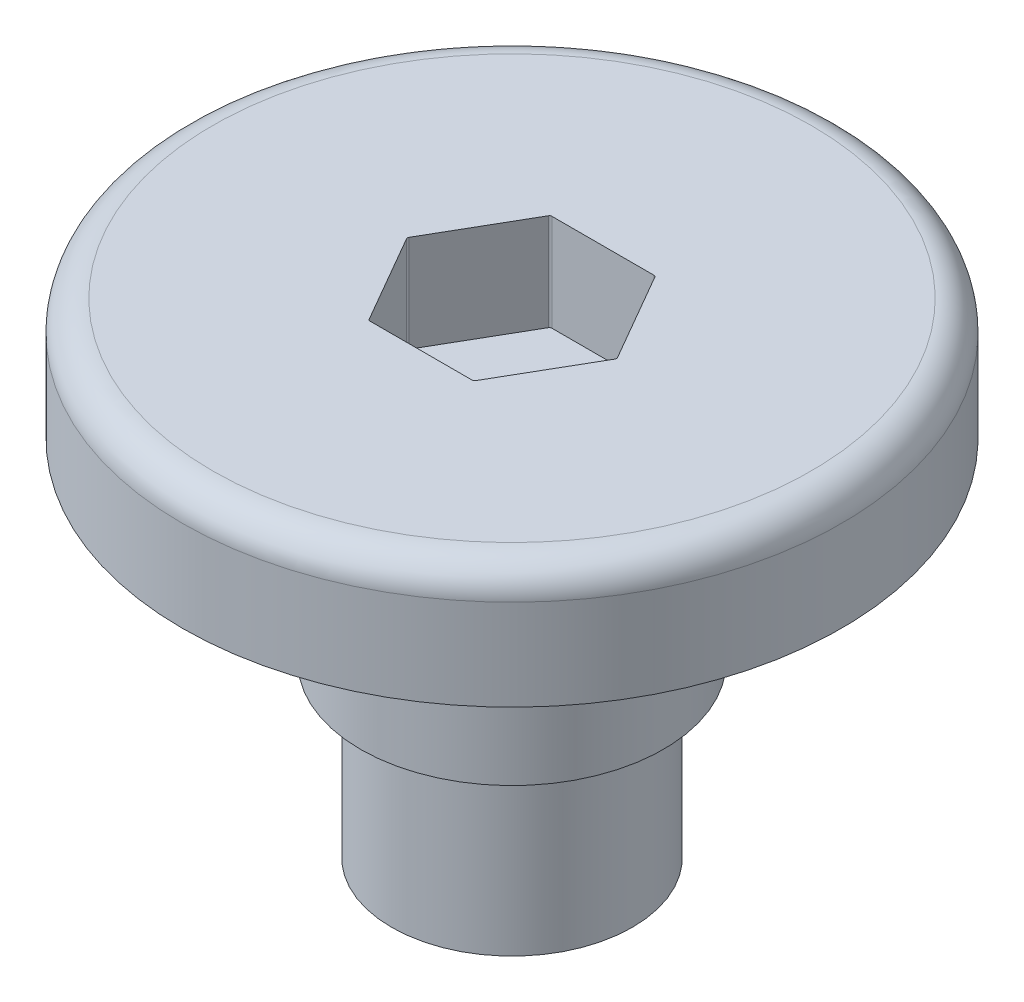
SolidWorks part; units mm, degrees
ref_plane "Front" through (0, 0, 0) normal (0, 0, 1) x (1, 0, 0)
ref_plane "Top" through (0, 0, 0) normal (0, 1, 0) x (1, 0, 0)
ref_plane "Right" through (0, 0, 0) normal (1, 0, 0) x (0, 0, -1)
sketch "Sketch1" plane through (0, 0, 0) normal (0, 0, 1) x (1, 0, 0)
  line L0 (0, 0) -> (0, 71.5624) construction
  line L1 (0, 0) -> (-6.3119, 0)
  line L2 (-7.9375, 8.89) -> (-7.9375, 13.2715)
  line L3 (-7.9375, 19.05) -> (-9.9822, 19.05)
  line L4 (-17.272, 19.05) -> (-17.272, 25.4)
  line L5 (-17.272, 25.4) -> (0, 25.4)
  line L6 (0, 25.4) -> (0, 0)
  line L7 (-10.1092, 19.177) -> (-10.1092, 21.2471)
  line L8 (-10.5537, 21.6916) -> (-14.2875, 21.6916)
  line L9 (-14.732, 21.2471) -> (-14.732, 19.177)
  line L10 (-14.859, 19.05) -> (-17.272, 19.05)
  line L11 (-7.8105, 17.018) -> (-6.1341, 17.018)
  line L12 (-5.8801, 16.764) -> (-5.8801, 13.6525)
  line L13 (-6.1341, 13.3985) -> (-7.8105, 13.3985)
  line L14 (-7.9375, 17.145) -> (-7.9375, 19.05)
  line L15 (-7.9375, 8.89) -> (-6.3119, 8.89)
  line L16 (-7.9375, 19.05) -> (-17.272, 19.304) construction
  line L18 (-6.3119, 8.89) -> (-6.3119, 0)
  arc A0 (-14.2875, 21.6916) -> (-14.732, 21.2471) centre (-14.2875, 21.2471) ccw
  arc A1 (-10.1092, 21.2471) -> (-10.5537, 21.6916) centre (-10.5537, 21.2471) ccw
  arc A2 (-10.1092, 19.177) -> (-9.9822, 19.05) centre (-9.9822, 19.177) ccw
  arc A3 (-14.732, 19.177) -> (-14.859, 19.05) centre (-14.859, 19.177) cw
  arc A4 (-6.1341, 17.018) -> (-5.8801, 16.764) centre (-6.1341, 16.764) cw
  arc A5 (-5.8801, 13.6525) -> (-6.1341, 13.3985) centre (-6.1341, 13.6525) cw
  arc A6 (-7.8105, 17.018) -> (-7.9375, 17.145) centre (-7.8105, 17.145) cw
  arc A7 (-7.8105, 13.3985) -> (-7.9375, 13.2715) centre (-7.8105, 13.2715) ccw
  point P20 (-13.1445, 19.05)
  point P33 (-7.9375, 17.018)
  point P36 (-17.272, 19.304)
  dimension "D8" = 0.4445
  dimension "D9" = 0.127
  dimension "D13" = 0.254
  dimension "D16" = 0.127
  dimension "D1" = 15.875
  dimension "D2" = 2.54
  dimension "D3" = 6.35
  dimension "D4" = 19.05
  dimension "D5" = 2.6416
  dimension "D6" = 4.6228
  dimension "D7" = 20.2184
  dimension "D10" = 3.6195
  dimension "D11" = 11.7602
  dimension "D12" = 0.254
  dimension "D14" = 12.6238
  dimension "D15" = 10.16
  dimension "D17" = 2.032
  dimension "D18" = 1.559
revolve "Revolve1" add sketch "Sketch1" angle 360 about L0
sketch "Sketch3" plane through (0, 25.4, 0) normal (0, 1, 0) x (1, 0, 0)
  line L1 (2.7496, 4.7625) -> (-2.7496, 4.7625)
  line L2 (-2.7496, 4.7625) -> (-5.4993, 0)
  line L3 (-5.4993, 0) -> (-2.7496, -4.7625)
  line L4 (-2.7496, -4.7625) -> (2.7496, -4.7625)
  line L5 (2.7496, -4.7625) -> (5.4993, 0)
  line L6 (5.4993, 0) -> (2.7496, 4.7625)
  circle A0 centre (0, 0) radius 4.7625 construction
  dimension "D1" = 9.525
extrude "Cut-Extrude1" cut sketch "Sketch3" against normal blind 5.08
fillet "Fillet1" radius 1.5875 1 edges at (0, 25.4, -17.272)
fillet "Fillet2" radius 0.127 6 edges at (-5.4993, 22.86, 0) (-2.7496, 22.86, 4.7625) (2.7496, 22.86, 4.7625) (5.4993, 22.86, 0) (2.7496, 22.86, -4.7625) (-2.7496, 22.86, -4.7625)
